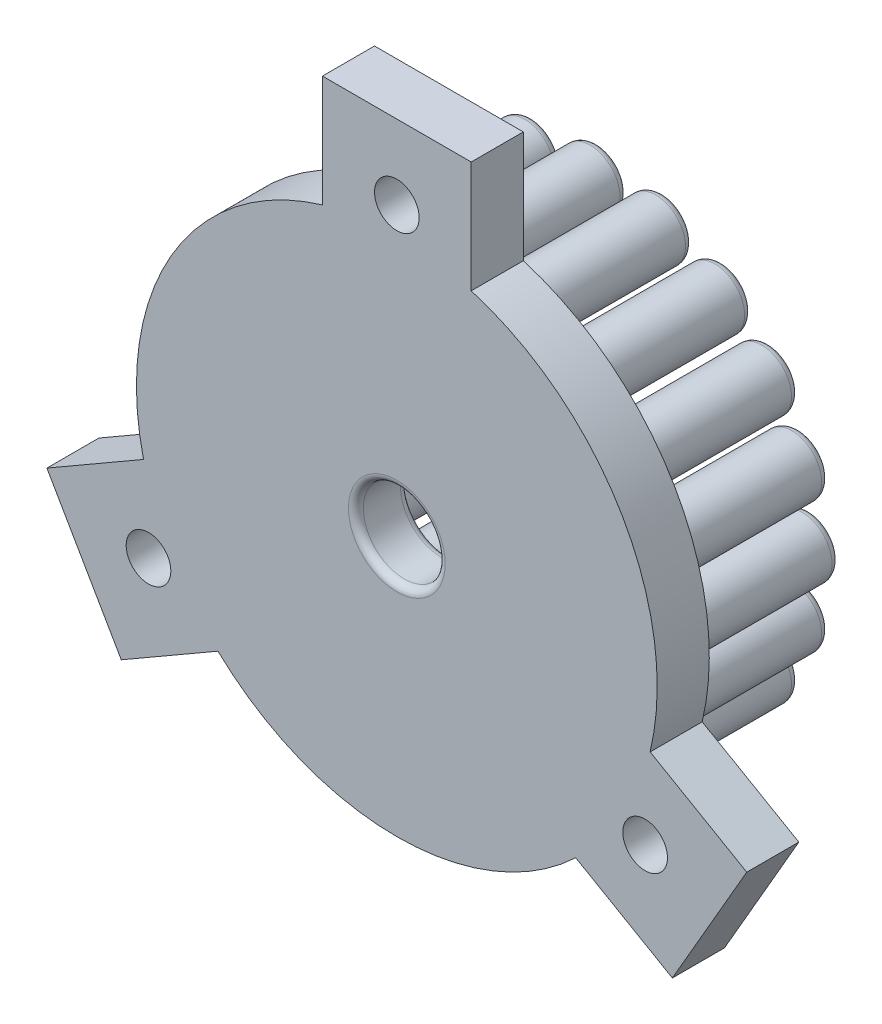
SolidWorks part; units mm, degrees
ref_plane "Ebene vorne" through (0, 0, 0) normal (0, 0, 1) x (1, 0, 0)
ref_plane "Ebene oben" through (0, 0, 0) normal (0, 1, 0) x (1, 0, 0)
ref_plane "Ebene rechts" through (0, 0, 0) normal (1, 0, 0) x (0, 0, -1)
sketch "Skizze1" plane through (0, 0, 0) normal (0, 0, 1) x (1, 0, 0)
  circle A0 centre (0, 0) radius 28.5
  circle A1 centre (0, 28.5) radius 4
  circle A2 centre (8.807, 27.1051) radius 4
  circle A3 centre (16.7519, 23.057) radius 4
  circle A4 centre (23.057, 16.7519) radius 4
  circle A5 centre (27.1051, 8.807) radius 4
  circle A6 centre (28.5, 0) radius 4
  circle A7 centre (27.1051, -8.807) radius 4
  circle A8 centre (23.057, -16.7519) radius 4
  circle A9 centre (16.7519, -23.057) radius 4
  circle A10 centre (8.807, -27.1051) radius 4
  circle A11 centre (0, -28.5) radius 4
  circle A12 centre (-8.807, -27.1051) radius 4
  circle A13 centre (-16.7519, -23.057) radius 4
  circle A14 centre (-23.057, -16.7519) radius 4
  circle A15 centre (-27.1051, -8.807) radius 4
  circle A16 centre (-28.5, 0) radius 4
  circle A17 centre (-27.1051, 8.807) radius 4
  circle A18 centre (-23.057, 16.7519) radius 4
  circle A19 centre (-16.7519, 23.057) radius 4
  circle A20 centre (-8.807, 27.1051) radius 4
  point P36 (0, 0)
  dimension "D1" = 57
  dimension "D2" = 20
  dimension "D3" = 8
extrude "Aufsatz-Linear austragen1" add sketch "Skizze1" along normal blind 20 contours A5 | A4 | A3 | A2 | A1 | A13 | A12 | A11 | A10 | A9 | A8 | A7 | A6 | A14 | A15 | A16 | A17 | A18 | A19 | A20
sketch "Skizze5" plane through (0, 0, 20) normal (0, 0, 1) x (1, 0, 0)
  circle A0 centre (0, 0) radius 35
  dimension "D1" = 70
extrude "Aufsatz-Linear austragen2" add sketch "Skizze5" along normal blind 7
sketch "Skizze6" plane through (0, 0, 27) normal (0, 0, 1) x (1, 0, 0)
  circle A0 centre (0, 0) radius 5.5
  dimension "D1" = 11
extrude "Schnitt-Linear austragen1" cut sketch "Skizze6" against normal blind 10
ref_plane "Ebene2" through (0, 0, 27) normal (0, 0, 1) x (1, 0, 0)
sketch "Skizze7" plane through (0, 0, 27) normal (0, 0, 1) x (1, 0, 0)
  line L1 (-10, 33.541) -> (10, 33.541)
  line L2 (-10, 33.541) -> (-10, 48.541)
  line L3 (-10, 48.541) -> (10, 48.541)
  line L4 (10, 33.541) -> (10, 48.541)
  line L12 (34.0474, -8.1103) -> (47.0378, -15.6103)
  line L13 (34.0474, -8.1103) -> (24.0474, -25.4308)
  line L14 (24.0474, -25.4308) -> (37.0378, -32.9308)
  line L15 (47.0378, -15.6103) -> (37.0378, -32.9308)
  line L16 (-24.0474, -25.4308) -> (-37.0378, -32.9308)
  line L17 (-24.0474, -25.4308) -> (-34.0474, -8.1103)
  line L18 (-34.0474, -8.1103) -> (-47.0378, -15.6103)
  line L19 (-37.0378, -32.9308) -> (-47.0378, -15.6103)
  circle A0 centre (0, 0) radius 35 construction
  point P18 (0, 0)
  dimension "D1" = 20
  dimension "D2" = 10
  dimension "D3" = 15
  dimension "D4" = 3
extrude "Aufsatz-Linear austragen3" add sketch "Skizze7" against normal blind 7
sketch "Skizze9" plane through (0, 0, 27) normal (0, 0, 1) x (1, 0, 0)
  line L0 (10, 48.541) -> (-10, 48.541) construction
  circle A0 centre (0, 38.541) radius 3
  circle A1 centre (33.3775, -19.2705) radius 3
  circle A2 centre (-33.3775, -19.2705) radius 3
  point P11 (0, 0)
  dimension "D1" = 6
  dimension "D2" = 10
  dimension "D3" = 3
extrude "Schnitt-Linear austragen3" cut sketch "Skizze9" against normal up to next
fillet "Verrundung1" radius 1 2 edges at (5.5, 0, 27) (5.5, 0, 20)
fillet "Verrundung2" radius 1 20 edges at (31.1051, 8.807, 0) (-12.7519, -23.057, 0) (-4.807, -27.1051, 0) (4, -28.5, 0) (12.807, -27.1051, 0) (20.7519, -23.057, 0) (27.057, -16.7519, 0) (31.1051, -8.807, 0) (32.5, 0, 0) (27.057, 16.7519, 0) (20.7519, 23.057, 0) (12.807, 27.1051, 0) (-19.057, -16.7519, 0) (-23.1051, -8.807, 0) (-24.5, 0, 0) (-23.1051, 8.807, 0) (-19.057, 16.7519, 0) (-12.7519, 23.057, 0) (-4.807, 27.1051, 0) (4, 28.5, 0)
